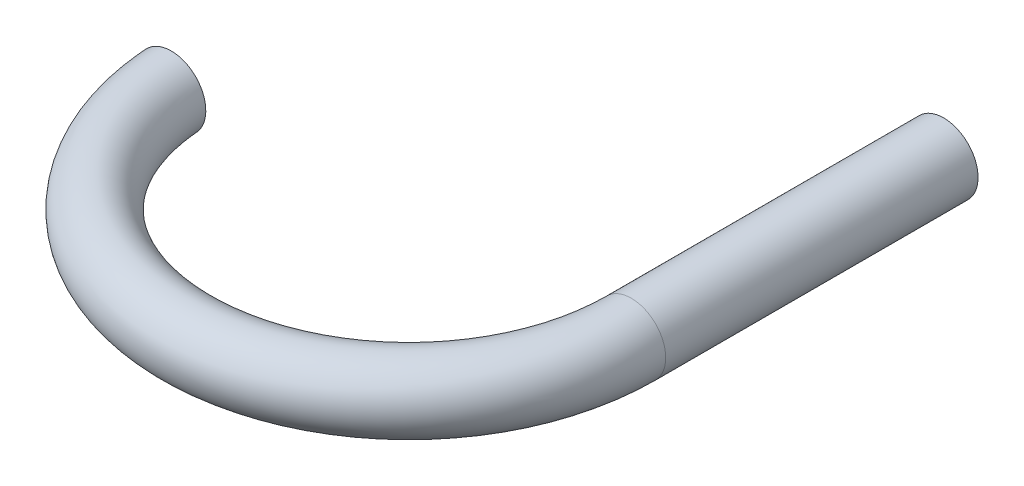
SolidWorks part; units mm, degrees
ref_plane "Piano1 (Front/Back)" through (0, 0, 0) normal (0, 0, 1) x (1, 0, 0)
ref_plane "Piano2 (Top/Bottom)" through (0, 0, 0) normal (0, 1, 0) x (1, 0, 0)
ref_plane "Piano3 (Left/Right)" through (0, 0, 0) normal (1, 0, 0) x (0, 0, -1)
imported_body "Importato1"
sketch "Schizzo1" plane through (0, 0, 15) normal (0, 0, -1) x (-1, 0, 0)
  line L0 (242.0357, -0.0007) -> (209.4504, -0.0007) construction
  line L1 (209.4504, -0.0007) -> (176.8651, -0.0007) construction
  circle A0 centre (209.4504, -0.0007) radius 32.5853 construction
  circle A1 centre (209.4504, -0.0007) radius 27.5
  spline S1 degree 3 number of poles 121 (232.153, -23.3198) -> (232.153, -23.3198) construction
  point P4 (209.4504, -0.0007)
  dimension "D1" = 55
extrude "Estrusione1" add sketch "Schizzo1" along normal blind 3
